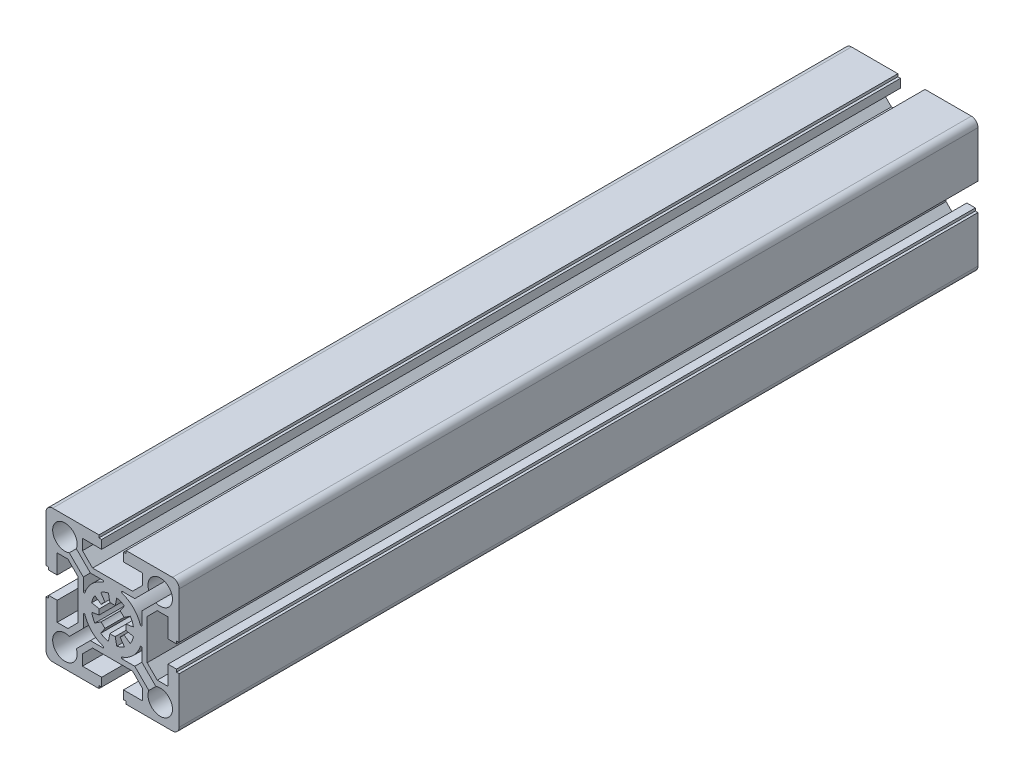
SolidWorks part; units mm, degrees
ref_plane "前视基准面" through (0, 0, 0) normal (0, 0, 1) x (1, 0, 0)
ref_plane "上视基准面" through (0, 0, 0) normal (0, 1, 0) x (1, 0, 0)
ref_plane "右视基准面" through (0, 0, 0) normal (1, 0, 0) x (0, 0, -1)
sketch "草图1" plane through (0, 0, 0) normal (0, 0, 1) x (1, 0, 0)
  line B0 (-4.2405, 2.8334) -> (-6.6518, 4.4446)
  line B1 (-7.8463, 1.5607) -> (-5.002, 0.995)
  line B2 (-5.002, -0.995) -> (-7.8463, -1.5607)
  line B3 (-6.6518, -4.4446) -> (-4.2405, -2.8334)
  line B4 (-2.8334, -4.2405) -> (-4.4446, -6.6518)
  line B5 (-1.5607, -7.8463) -> (-0.995, -5.002)
  line B6 (0.995, -5.002) -> (1.5607, -7.8463)
  line B7 (4.4446, -6.6518) -> (2.8334, -4.2405)
  line B8 (4.2405, -2.8334) -> (6.6518, -4.4446)
  line B9 (7.8463, -1.5607) -> (5.002, -0.995)
  line B10 (5.002, 0.995) -> (7.8463, 1.5607)
  line B11 (6.6518, 4.4446) -> (4.2405, 2.8334)
  line B12 (2.8334, 4.2405) -> (4.4446, 6.6518)
  line B13 (1.5607, 7.8463) -> (0.995, 5.002)
  line B14 (-0.995, 5.002) -> (-1.5607, 7.8463)
  line B15 (-4.4446, 6.6518) -> (-2.8334, 4.2405)
  line B16 (13.604, 16.2556) -> (8.3483, 11)
  line B17 (8.3483, 11) -> (3.6332, 11)
  line B18 (11, 3.6332) -> (11, 8.3483)
  line B19 (11, 8.3483) -> (16.2556, 13.604)
  line B20 (-16.2556, 13.604) -> (-11, 8.3483)
  line B21 (-11, 8.3483) -> (-11, 3.6332)
  line B22 (-3.6332, 11) -> (-8.3483, 11)
  line B23 (-8.3483, 11) -> (-13.604, 16.2556)
  line B24 (8.3483, -11) -> (13.604, -16.2556)
  line B25 (16.2556, -13.604) -> (11, -8.3483)
  line B26 (11, -8.3483) -> (11, -3.6332)
  line B27 (3.6332, -11) -> (8.3483, -11)
  line B28 (-13.604, -16.2556) -> (-8.3483, -11)
  line B29 (-8.3483, -11) -> (-3.6332, -11)
  line B30 (-11, -3.6332) -> (-11, -8.3483)
  line B31 (-11, -8.3483) -> (-16.2556, -13.604)
  line B32 (-13, 7.5199) -> (-13, 0)
  line B33 (-13, 0) -> (-13, -7.5199)
  line B34 (-13, -7.5199) -> (-16.7801, -11.3)
  line B35 (-16.7801, -11.3) -> (-20.8, -11.3)
  line B36 (-20.8, -11.3) -> (-20.8, -4.1)
  line B37 (-20.8, -4.1) -> (-24, -4.1)
  line B38 (-24, -4.1) -> (-24, -5.1)
  line B39 (-24, -5.1) -> (-25, -5.1)
  line B40 (-25, -5.1) -> (-25, -22.5)
  line B41 (-22.5, -25) -> (-5.1, -25)
  line B42 (-5.1, -25) -> (-5.1, -24)
  line B43 (-5.1, -24) -> (-4.1, -24)
  line B44 (-4.1, -24) -> (-4.1, -20.8)
  line B45 (-4.1, -20.8) -> (-11.3, -20.8)
  line B46 (-11.3, -20.8) -> (-11.3, -16.7801)
  line B47 (-11.3, -16.7801) -> (-7.5199, -13)
  line B48 (-7.5199, -13) -> (0, -13)
  line B49 (0, -13) -> (7.5199, -13)
  line B50 (7.5199, -13) -> (11.3, -16.7801)
  line B51 (11.3, -16.7801) -> (11.3, -20.8)
  line B52 (11.3, -20.8) -> (4.1, -20.8)
  line B53 (4.1, -20.8) -> (4.1, -24)
  line B54 (4.1, -24) -> (5.1, -24)
  line B55 (5.1, -24) -> (5.1, -25)
  line B56 (5.1, -25) -> (22.5, -25)
  line B57 (25, -22.5) -> (25, -5.1)
  line B58 (25, -5.1) -> (24, -5.1)
  line B59 (24, -5.1) -> (24, -4.1)
  line B60 (24, -4.1) -> (20.8, -4.1)
  line B61 (20.8, -4.1) -> (20.8, -11.3)
  line B62 (20.8, -11.3) -> (16.7801, -11.3)
  line B63 (16.7801, -11.3) -> (13, -7.5199)
  line B64 (13, -7.5199) -> (13, 0)
  line B65 (13, 0) -> (13, 7.5199)
  line B66 (13, 7.5199) -> (16.7801, 11.3)
  line B67 (16.7801, 11.3) -> (20.8, 11.3)
  line B68 (20.8, 11.3) -> (20.8, 4.1)
  line B69 (20.8, 4.1) -> (24, 4.1)
  line B70 (24, 4.1) -> (24, 5.1)
  line B71 (24, 5.1) -> (25, 5.1)
  line B72 (25, 5.1) -> (25, 22.5)
  line B73 (22.5, 25) -> (5.1, 25)
  line B74 (5.1, 25) -> (5.1, 24)
  line B75 (5.1, 24) -> (4.1, 24)
  line B76 (4.1, 24) -> (4.1, 20.8)
  line B77 (4.1, 20.8) -> (11.3, 20.8)
  line B78 (11.3, 20.8) -> (11.3, 16.7801)
  line B79 (11.3, 16.7801) -> (7.5199, 13)
  line B80 (7.5199, 13) -> (0, 13)
  line B81 (0, 13) -> (-7.5199, 13)
  line B82 (-7.5199, 13) -> (-11.3, 16.7801)
  line B83 (-11.3, 16.7801) -> (-11.3, 20.8)
  line B84 (-11.3, 20.8) -> (-4.1, 20.8)
  line B85 (-4.1, 20.8) -> (-4.1, 24)
  line B86 (-4.1, 24) -> (-5.1, 24)
  line B87 (-5.1, 24) -> (-5.1, 25)
  line B88 (-5.1, 25) -> (-22.5, 25)
  line B89 (-25, 22.5) -> (-25, 5.1)
  line B90 (-25, 5.1) -> (-24, 5.1)
  line B91 (-24, 5.1) -> (-24, 4.1)
  line B92 (-24, 4.1) -> (-20.8, 4.1)
  line B93 (-20.8, 4.1) -> (-20.8, 11.3)
  line B94 (-20.8, 11.3) -> (-16.7801, 11.3)
  line B95 (-16.7801, 11.3) -> (-13, 7.5199)
  arc B96 (-2.8334, 4.2405) -> (-3.6062, 3.6062) centre (0, 0) ccw
  arc B97 (-3.6062, 3.6062) -> (-4.2405, 2.8334) centre (0, 0) ccw
  arc B98 (-6.6518, 4.4446) -> (-7.8463, 1.5607) centre (0, 0) ccw
  arc B99 (-5.002, 0.995) -> (-5.1, 0) centre (0, 0) ccw
  arc B100 (-5.1, 0) -> (-5.002, -0.995) centre (0, 0) ccw
  arc B101 (-7.8463, -1.5607) -> (-6.6518, -4.4446) centre (0, 0) ccw
  arc B102 (-4.2405, -2.8334) -> (-3.6062, -3.6062) centre (0, 0) ccw
  arc B103 (-3.6062, -3.6062) -> (-2.8334, -4.2405) centre (0, 0) ccw
  arc B104 (-4.4446, -6.6518) -> (-1.5607, -7.8463) centre (0, 0) ccw
  arc B105 (-0.995, -5.002) -> (0, -5.1) centre (0, 0) ccw
  arc B106 (0, -5.1) -> (0.995, -5.002) centre (0, 0) ccw
  arc B107 (1.5607, -7.8463) -> (4.4446, -6.6518) centre (0, 0) ccw
  arc B108 (2.8334, -4.2405) -> (3.6062, -3.6062) centre (0, 0) ccw
  arc B109 (3.6062, -3.6062) -> (4.2405, -2.8334) centre (0, 0) ccw
  arc B110 (6.6518, -4.4446) -> (7.8463, -1.5607) centre (0, 0) ccw
  arc B111 (5.002, -0.995) -> (5.1, 0) centre (0, 0) ccw
  arc B112 (5.1, 0) -> (5.002, 0.995) centre (0, 0) ccw
  arc B113 (7.8463, 1.5607) -> (6.6518, 4.4446) centre (0, 0) ccw
  arc B114 (4.2405, 2.8334) -> (3.6062, 3.6062) centre (0, 0) ccw
  arc B115 (3.6062, 3.6062) -> (2.8334, 4.2405) centre (0, 0) ccw
  arc B116 (4.4446, 6.6518) -> (1.5607, 7.8463) centre (0, 0) ccw
  arc B117 (0.995, 5.002) -> (0, 5.1) centre (0, 0) ccw
  arc B118 (0, 5.1) -> (-0.995, 5.002) centre (0, 0) ccw
  arc B119 (-1.5607, 7.8463) -> (-4.4446, 6.6518) centre (0, 0) ccw
  arc B120 (3.6332, 11) -> (3.5367, 10.4159) centre (3.6332, 10.7) ccw
  arc B121 (10.4159, 3.5367) -> (3.5367, 10.4159) centre (0, 0) ccw
  arc B122 (10.4159, 3.5367) -> (11, 3.6332) centre (10.7, 3.6332) ccw
  arc B123 (16.2556, 13.604) -> (21.1527, 21.1527) centre (17.9, 17.9) ccw
  arc B124 (21.1527, 21.1527) -> (13.604, 16.2556) centre (17.9, 17.9) ccw
  arc B125 (-13.604, 16.2556) -> (-21.1527, 21.1527) centre (-17.9, 17.9) ccw
  arc B126 (-21.1527, 21.1527) -> (-16.2556, 13.604) centre (-17.9, 17.9) ccw
  arc B127 (-11, 3.6332) -> (-10.4159, 3.5367) centre (-10.7, 3.6332) ccw
  arc B128 (-3.5367, 10.4159) -> (-10.4159, 3.5367) centre (0, 0) ccw
  arc B129 (-3.5367, 10.4159) -> (-3.6332, 11) centre (-3.6332, 10.7) ccw
  arc B130 (13.604, -16.2556) -> (21.1527, -21.1527) centre (17.9, -17.9) ccw
  arc B131 (21.1527, -21.1527) -> (16.2556, -13.604) centre (17.9, -17.9) ccw
  arc B132 (11, -3.6332) -> (10.4159, -3.5367) centre (10.7, -3.6332) ccw
  arc B133 (3.5367, -10.4159) -> (10.4159, -3.5367) centre (0, 0) ccw
  arc B134 (3.5367, -10.4159) -> (3.6332, -11) centre (3.6332, -10.7) ccw
  arc B135 (-3.6332, -11) -> (-3.5367, -10.4159) centre (-3.6332, -10.7) ccw
  arc B136 (-10.4159, -3.5367) -> (-3.5367, -10.4159) centre (0, 0) ccw
  arc B137 (-10.4159, -3.5367) -> (-11, -3.6332) centre (-10.7, -3.6332) ccw
  arc B138 (-16.2556, -13.604) -> (-21.1527, -21.1527) centre (-17.9, -17.9) ccw
  arc B139 (-21.1527, -21.1527) -> (-13.604, -16.2556) centre (-17.9, -17.9) ccw
  arc B140 (-25, -22.5) -> (-22.5, -25) centre (-22.5, -22.5) ccw
  arc B141 (22.5, -25) -> (25, -22.5) centre (22.5, -22.5) ccw
  arc B142 (25, 22.5) -> (22.5, 25) centre (22.5, 22.5) ccw
  arc B143 (-22.5, 25) -> (-25, 22.5) centre (-22.5, 22.5) ccw
sketch_block_instance "A$C66DE7276-1"
sketch_block "A$C66DE7276"
extrude "凸台-拉伸1" add sketch "草图1" along normal mid plane 300
